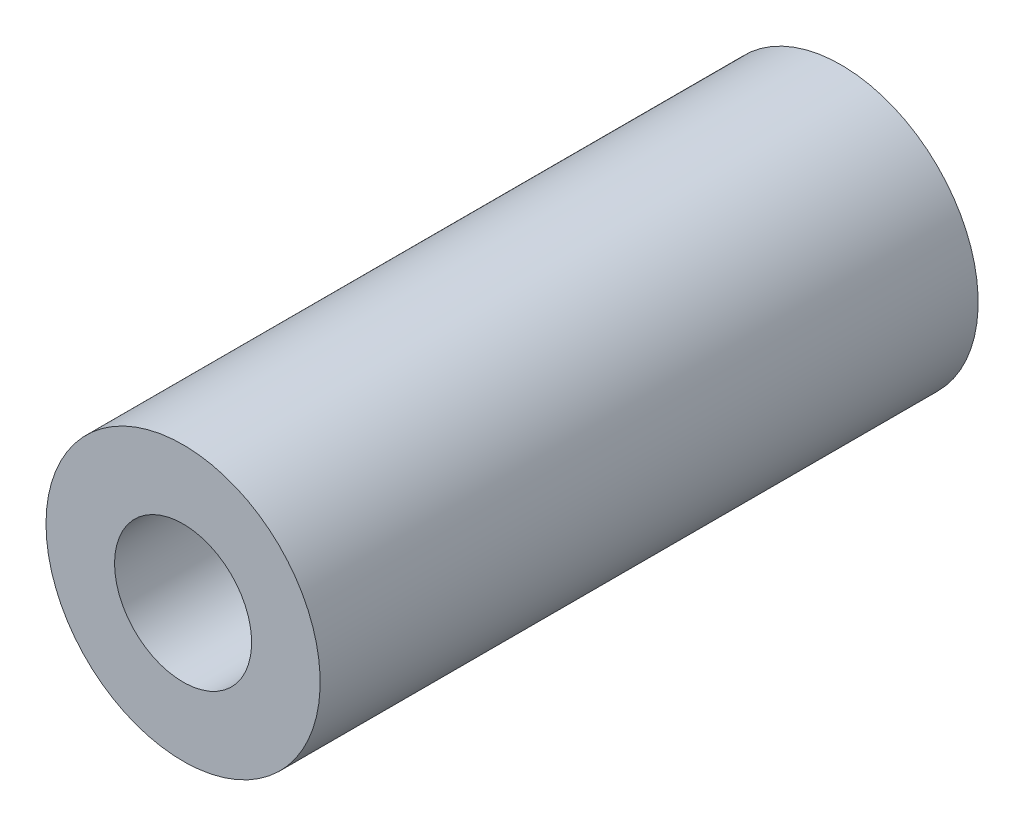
SolidWorks part; units mm, degrees
ref_plane "Front Plane" through (0, 0, 0) normal (0, 0, 1) x (1, 0, 0)
ref_plane "Top Plane" through (0, 0, 0) normal (0, 1, 0) x (1, 0, 0)
ref_plane "Right Plane" through (0, 0, 0) normal (1, 0, 0) x (0, 0, -1)
sketch "Sketch1" plane through (0, 0, 0) normal (0, 0, 1) x (1, 0, 0)
  circle A0 centre (0, 0) radius 3.175
  circle A1 centre (0, 0) radius 6.35
  dimension "D1" = 6.35
  dimension "D2" = 12.7
extrude "Boss-Extrude1" add sketch "Sketch1" along normal blind 30.48
